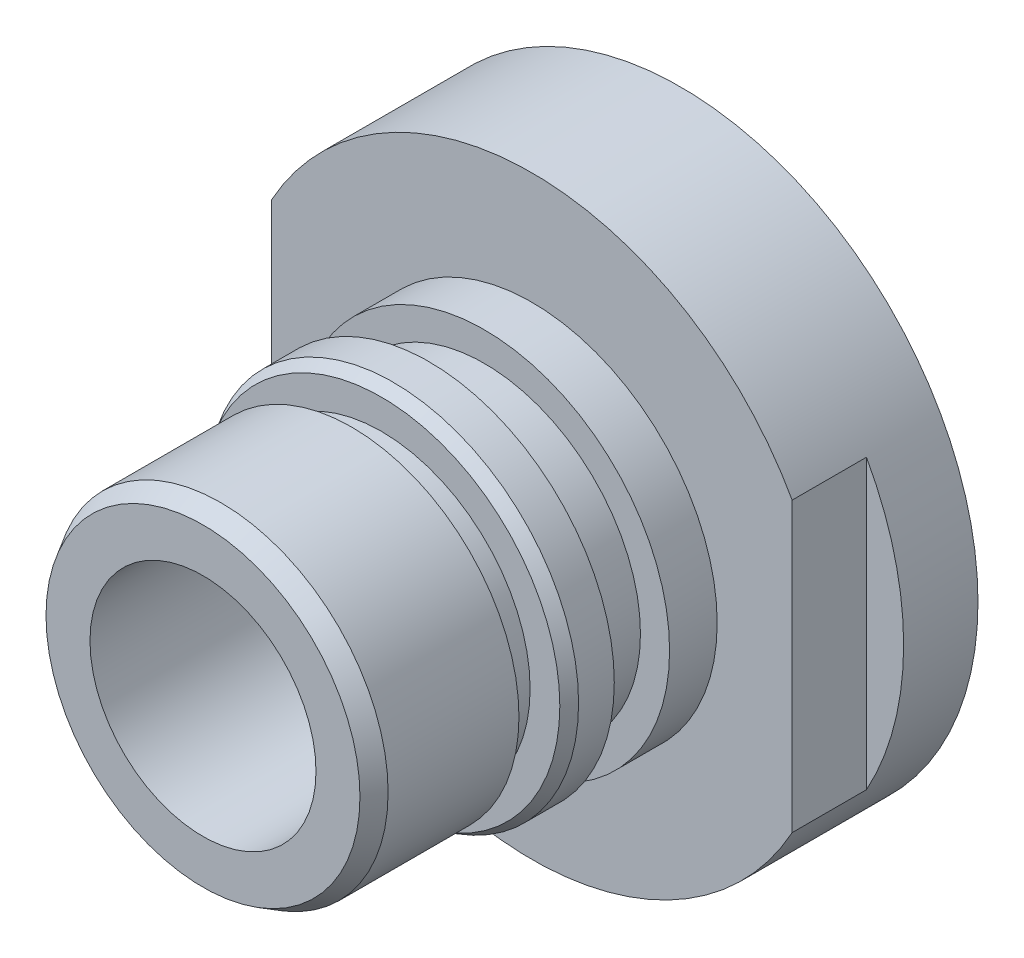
SolidWorks part; units mm, degrees
ref_plane "Plane1" through (0, 0, 0) normal (0, 0, 1) x (1, 0, 0)
ref_plane "Plane2" through (0, 0, 0) normal (0, 1, 0) x (1, 0, 0)
ref_plane "Plane3" through (0, 0, 0) normal (1, 0, 0) x (0, 0, -1)
sketch "Sketch1" plane through (0, 0, 0) normal (0, 0, 1) x (1, 0, 0)
  circle A0 centre (0, 0) radius 12.7
  dimension "D1" = 25.4
extrude "bladder_base" add sketch "Sketch1" along normal blind 6.35
sketch "Sketch5" plane through (0, 0, 6.35) normal (0, 0, 1) x (1, 0, 0)
  circle A0 centre (0, 0) radius 7.9121
  dimension "D1" = 15.8242
sketch "Sketch16" plane through (0, 0, 0) normal (0, 0, -1) x (-1, 0, 0)
  circle A0 centre (0, 0) radius 5.5753
  dimension "D1" = 11.1506
extrude "oring_base" add sketch "Sketch5" along normal blind 2.032
sketch "Sketch17" plane through (0, 0, 8.382) normal (0, 0, 1) x (1, 0, 0)
  circle A0 centre (0, 0) radius 6.6675
  dimension "D1" = 13.335
extrude "oring_groove" add sketch "Sketch17" along normal blind 2.3622
sketch "Sketch18" plane through (0, 0, 10.7442) normal (0, 0, 1) x (1, 0, 0)
  circle A0 centre (0, 0) radius 7.9121
  dimension "D1" = 15.8242
extrude "oring_base2" add sketch "Sketch18" along normal blind 2.032
sketch "Sketch19" plane through (0, 0, 12.7762) normal (0, 0, 1) x (1, 0, 0)
  circle A0 centre (0, 0) radius 7.1438
  dimension "D1" = 14.2875
extrude "thread_plug" add sketch "Sketch19" along normal blind 7.62
extrude "bladder_cbore" cut sketch "Sketch16" against normal blind 7.62
sketch "Sketch22" plane through (0, 0, 7.62) normal (0, 0, -1) x (-1, 0, 0)
  circle A0 centre (0, 0) radius 3.175
  dimension "D1" = 6.35
extrude "thru_hole" cut sketch "Sketch22" against normal blind 2.54
sketch "Sketch23" plane through (0, 0, 10.16) normal (0, 0, -1) x (-1, 0, 0)
  circle A0 centre (0, 0) radius 4.826
  dimension "D1" = 9.652
extrude "bolt_cbore" cut sketch "Sketch23" against normal blind 12.7
chamfer "Chamfer1" distance 0.762 angle 30
sketch "Sketch24" plane through (0, 0, 12.7762) normal (0, 0, 1) x (1, 0, 0)
  circle A0 centre (0, 0) radius 6.35
  dimension "D1" = 12.7
extrude "Cut-Extrude9" cut sketch "Sketch24" along normal blind 1.27 flip side to cut
sketch "Sketch26" plane through (0, 0, 0) normal (0, 1, 0) x (1, 0, 0)
  line L0 (2.54, -0.3302) -> (2.9464, 0.0762)
  line L1 (0, 0) -> (0, 10.1936) construction
  line L2 (0, -6.35) -> (0, 0) construction
  line L3 (2.9464, 0.0762) -> (3.263, -0.2404)
  line L4 (3.4426, -0.2404) -> (3.6694, -0.0136)
  line L5 (3.849, -0.0136) -> (4.0758, -0.2404)
  line L6 (4.2554, -0.2404) -> (4.4822, -0.0136)
  line L7 (4.6618, -0.0136) -> (4.8886, -0.2404)
  line L8 (5.0682, -0.2404) -> (5.295, -0.0136)
  line L9 (5.4746, -0.0136) -> (5.7014, -0.2404)
  line L10 (5.881, -0.2404) -> (6.1078, -0.0136)
  line L11 (6.2874, -0.0136) -> (6.5142, -0.2404)
  line L12 (6.6938, -0.2404) -> (6.9206, -0.0136)
  line L13 (7.1002, -0.0136) -> (7.327, -0.2404)
  line L14 (7.5066, -0.2404) -> (7.7334, -0.0136)
  line L15 (7.913, -0.0136) -> (8.1398, -0.2404)
  line L16 (13.5128, 0.0762) -> (13.5128, 2.6383)
  line L17 (2.54, -0.3302) -> (2.54, 2.6383)
  line L18 (2.54, 2.6383) -> (13.5128, 2.6383)
  line L19 (8.3194, -0.2404) -> (8.5462, -0.0136)
  line L20 (8.7258, -0.0136) -> (8.9526, -0.2404)
  line L21 (9.1322, -0.2404) -> (9.359, -0.0136)
  line L22 (9.5386, -0.0136) -> (9.7654, -0.2404)
  line L23 (9.945, -0.2404) -> (10.1718, -0.0136)
  line L24 (10.3514, -0.0136) -> (10.5782, -0.2404)
  line L25 (10.7578, -0.2404) -> (10.9846, -0.0136)
  line L26 (11.1642, -0.0136) -> (11.391, -0.2404)
  line L27 (11.5706, -0.2404) -> (11.7974, -0.0136)
  line L28 (11.977, -0.0136) -> (12.2038, -0.2404)
  line L29 (12.3834, -0.2404) -> (12.6102, -0.0136)
  line L30 (12.7898, -0.0136) -> (13.0166, -0.2404)
  line L31 (13.1962, -0.2404) -> (13.5128, 0.0762)
  arc A0 (3.4426, -0.2404) -> (3.263, -0.2404) centre (3.3528, -0.1506) cw
  arc A1 (3.849, -0.0136) -> (3.6694, -0.0136) centre (3.7592, -0.1034) ccw
  arc A2 (4.2554, -0.2404) -> (4.0758, -0.2404) centre (4.1656, -0.1506) cw
  arc A3 (4.6618, -0.0136) -> (4.4822, -0.0136) centre (4.572, -0.1034) ccw
  arc A4 (5.0682, -0.2404) -> (4.8886, -0.2404) centre (4.9784, -0.1506) cw
  arc A5 (5.4746, -0.0136) -> (5.295, -0.0136) centre (5.3848, -0.1034) ccw
  arc A6 (5.881, -0.2404) -> (5.7014, -0.2404) centre (5.7912, -0.1506) cw
  arc A7 (6.2874, -0.0136) -> (6.1078, -0.0136) centre (6.1976, -0.1034) ccw
  arc A8 (6.6938, -0.2404) -> (6.5142, -0.2404) centre (6.604, -0.1506) cw
  arc A9 (7.1002, -0.0136) -> (6.9206, -0.0136) centre (7.0104, -0.1034) ccw
  arc A10 (7.5066, -0.2404) -> (7.327, -0.2404) centre (7.4168, -0.1506) cw
  arc A11 (7.913, -0.0136) -> (7.7334, -0.0136) centre (7.8232, -0.1034) ccw
  arc A12 (8.3194, -0.2404) -> (8.1398, -0.2404) centre (8.2296, -0.1506) cw
  arc A13 (8.7258, -0.0136) -> (8.5462, -0.0136) centre (8.636, -0.1034) ccw
  arc A14 (9.1322, -0.2404) -> (8.9526, -0.2404) centre (9.0424, -0.1506) cw
  arc A15 (9.5386, -0.0136) -> (9.359, -0.0136) centre (9.4488, -0.1034) ccw
  arc A16 (9.945, -0.2404) -> (9.7654, -0.2404) centre (9.8552, -0.1506) cw
  arc A17 (10.3514, -0.0136) -> (10.1718, -0.0136) centre (10.2616, -0.1034) ccw
  arc A18 (10.7578, -0.2404) -> (10.5782, -0.2404) centre (10.668, -0.1506) cw
  arc A19 (11.1642, -0.0136) -> (10.9846, -0.0136) centre (11.0744, -0.1034) ccw
  arc A20 (11.5706, -0.2404) -> (11.391, -0.2404) centre (11.4808, -0.1506) cw
  arc A21 (11.977, -0.0136) -> (11.7974, -0.0136) centre (11.8872, -0.1034) ccw
  arc A22 (12.3834, -0.2404) -> (12.2038, -0.2404) centre (12.2936, -0.1506) cw
  arc A23 (12.7898, -0.0136) -> (12.6102, -0.0136) centre (12.7, -0.1034) ccw
  arc A24 (13.1962, -0.2404) -> (13.0166, -0.2404) centre (13.1064, -0.1506) cw
  dimension "D4" = 0.127
  dimension "D5" = 0.127
  dimension "D1" = 0.4064
  dimension "D2" = 0.3302
  dimension "D3" = 0.4064
revolve "Cut-Revolve1" cut sketch "Sketch26" angle 360 about L1
chamfer "Chamfer2" distance 0.508 angle 30
sketch "Sketch27" plane through (0, 0, 6.35) normal (0, 0, 1) x (1, 0, 0)
  line L0 (0, 0) -> (0, 12.7) construction
  line L1 (-15.2744, 11.1125) -> (-11.1125, 11.1125)
  line L2 (-15.2744, -11.1125) -> (-15.2744, 11.1125)
  line L3 (-11.1125, -11.1125) -> (-15.2744, -11.1125)
  line L4 (-11.1125, 11.1125) -> (-11.1125, -11.1125)
  line L10 (11.1125, 11.1125) -> (11.1125, -11.1125)
  line L11 (11.1125, -11.1125) -> (15.2744, -11.1125)
  line L12 (15.2744, -11.1125) -> (15.2744, 11.1125)
  line L13 (15.2744, 11.1125) -> (11.1125, 11.1125)
  circle A0 centre (0, 0) radius 12.7 construction
  dimension "D1" = 11.1125
extrude "Cut-Extrude10" cut sketch "Sketch27" against normal blind 3.175
